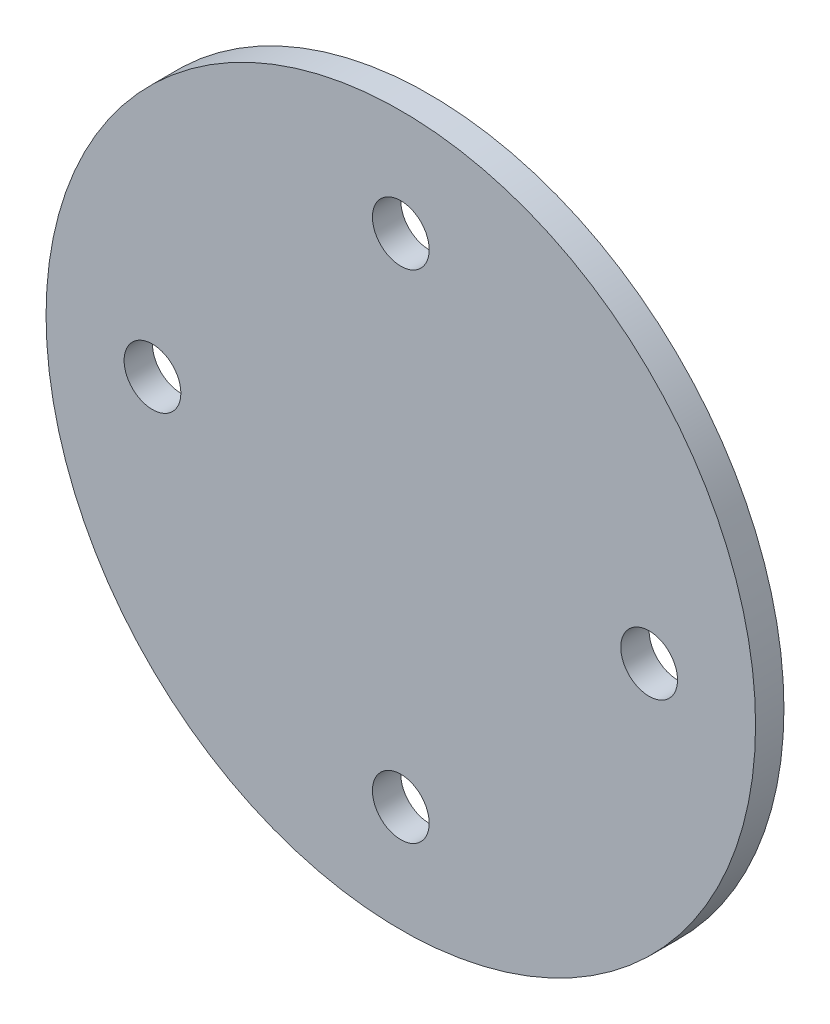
SolidWorks part; units mm, degrees
ref_plane "Front Plane" through (0, 0, 0) normal (0, 0, 1) x (1, 0, 0)
ref_plane "Top Plane" through (0, 0, 0) normal (0, 1, 0) x (1, 0, 0)
ref_plane "Right Plane" through (0, 0, 0) normal (1, 0, 0) x (0, 0, -1)
sketch "Sketch1" plane through (0, 0, 0) normal (0, 0, 1) x (1, 0, 0)
  line L0 (0, 0) -> (0, 35) construction
  line L1 (0, 0) -> (0, 35) construction
  line L2 (0, 0) -> (35, 0) construction
  circle A0 centre (0, 0) radius 50
  circle A1 centre (0, 35) radius 4
  circle A2 centre (35, 0) radius 4
  circle A3 centre (0, -35) radius 4
  circle A4 centre (-35, 0) radius 4
  circle A10 centre (0, -35) radius 4
  circle A11 centre (-35, 0) radius 4
  circle A12 centre (0, 35) radius 4
  circle A13 centre (0, 35) radius 4
  circle A14 centre (35, 0) radius 4
  dimension "D1" = 100
  dimension "D2" = 8
  dimension "D4" = 90
  dimension "D5" = 35
extrude "Extrude1" add sketch "Sketch1" along normal blind 4
